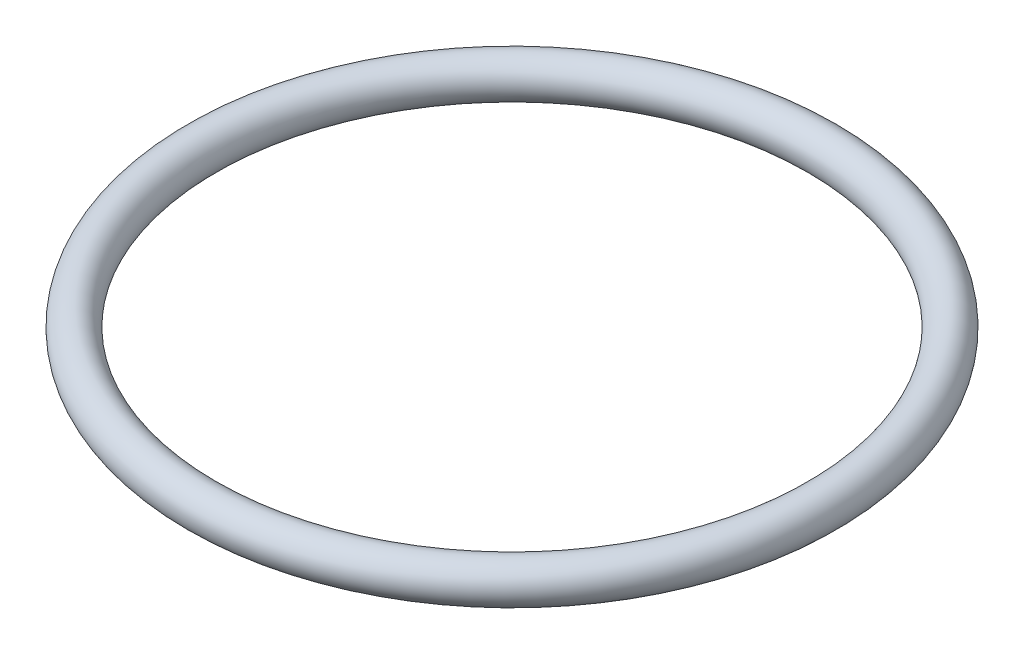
SolidWorks part; units mm, degrees
ref_plane "Face" through (0, 0, 0) normal (0, 0, 1) x (1, 0, 0)
ref_plane "Dessus" through (0, 0, 0) normal (0, 1, 0) x (1, 0, 0)
ref_plane "Droite" through (0, 0, 0) normal (1, 0, 0) x (0, 0, -1)
sketch "Esquisse1" plane through (0, 0, 0) normal (0, 0, 1) x (1, 0, 0)
  line L0 (0, 29.9585) -> (0, -6.9563) construction
  line L1 (-11, 22) -> (-11, 20) construction
  line L2 (12.5, 20) -> (-12.5, 20) construction
  circle A0 centre (-11.75, 21) radius 0.75
  dimension "D1" = 1.5
  dimension "D2" = 1
revolve "Révolution1" add sketch "Esquisse1" angle 360 about L0
